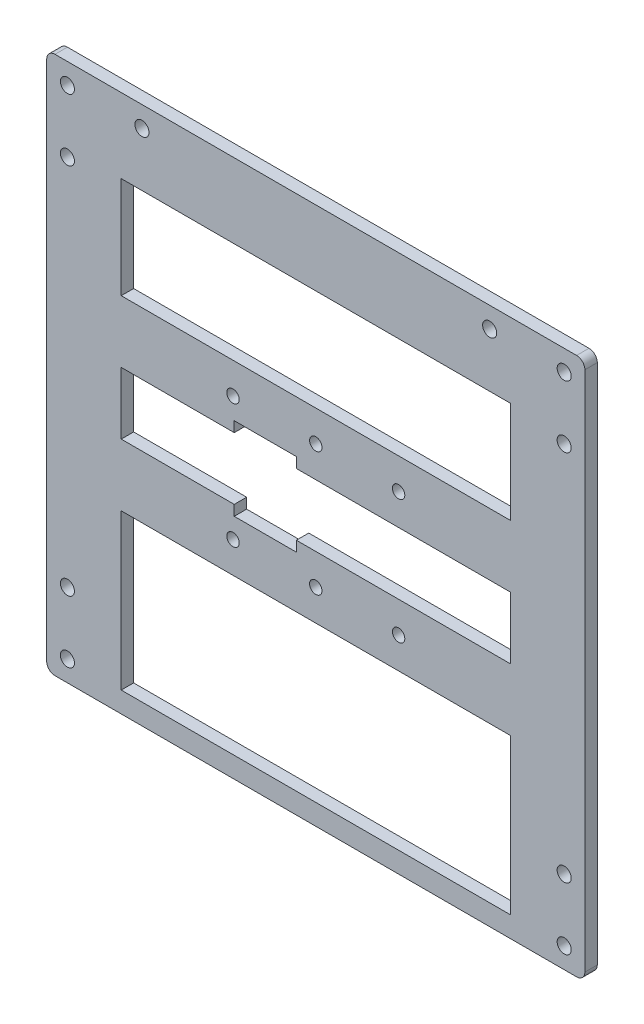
SolidWorks part; units mm, degrees
ref_plane "前视基准面" through (0, 0, 0) normal (0, 0, 1) x (1, 0, 0)
ref_plane "上视基准面" through (0, 0, 0) normal (0, 1, 0) x (1, 0, 0)
ref_plane "右视基准面" through (0, 0, 0) normal (1, 0, 0) x (0, 0, -1)
sketch "草图1" plane through (0, 0, 0) normal (0, 0, 1) x (1, 0, 0)
  line L1 (-65, 65) -> (65, 65)
  line L2 (-65, 65) -> (-65, -65)
  line L3 (-65, -65) -> (65, -65)
  line L4 (65, 65) -> (65, -65)
  line L5 (-65, 65) -> (65, -65) construction
  line L6 (-65, -65) -> (65, 65) construction
  point P0 (0, 0)
  dimension "D1" = 130
  dimension "D2" = 130
extrude "凸台-拉伸1" add sketch "草图1" along normal blind 3
hole_wizard "Ø3.0 (3) 直径孔1" positions "草图4" profile "草图3" hole size "Ø3.0" standard "GB"
sketch "草图4" plane through (0, 0, 3) normal (0, 0, 1) x (1, 0, 0)
  point P0 (-20, 15)
  point P3 (-20, -15)
  point P6 (20, -15)
  point P9 (20, 15)
  dimension "D1" = 40
  dimension "D2" = 40
  dimension "D3" = 30
  dimension "D4" = 30
  dimension "D5" = 15
  dimension "D6" = 20
  dimension "D7" = 20
  dimension "D8" = 15
sketch "草图3" plane through (-20, 15, 3) normal (1, 0, 0) x (0, -1, 0)
  line L0 (0, 0) -> (0, 3)
  line L1 (0, 3) -> (1.5, 3)
  line L2 (1.5, 3) -> (1.5, 0)
  line L5 (1.5, 0) -> (0, 0)
  line L11 (0, -6.35) -> (0, 107.95) construction
  dimension "通孔孔直径" = 3
  dimension "通孔孔深度" = 3
sketch "草图5" plane through (0, 0, 3) normal (0, 0, 1) x (1, 0, 0)
  line L1 (-47, 32.5) -> (47, 32.5)
  line L2 (-47, 32.5) -> (-47, 22.5)
  line L3 (-47, 22.5) -> (47, 22.5)
  line L4 (47, 32.5) -> (47, 22.5)
  line L5 (-47, 7.5) -> (47, 7.5)
  line L6 (-47, 7.5) -> (-47, -7.5)
  line L7 (-47, -7.5) -> (47, -7.5)
  line L8 (47, 7.5) -> (47, -7.5)
  line L9 (-47, 7.5) -> (47, -7.5) construction
  line L10 (-47, -7.5) -> (47, 7.5) construction
  line L11 (-47, -22.5) -> (47, -22.5)
  line L12 (-47, -22.5) -> (-47, -32.5)
  line L13 (-47, -32.5) -> (47, -32.5)
  line L14 (47, -22.5) -> (47, -32.5)
  point P4 (0, 0)
  dimension "D1" = 15
  dimension "D2" = 94
  dimension "D3" = 94
  dimension "D4" = 94
  dimension "D5" = 47
  dimension "D6" = 47
  dimension "D7" = 10
  dimension "D8" = 10
  dimension "D9" = 15
  dimension "D10" = 15
extrude "切除-拉伸1" cut sketch "草图5" against normal blind 3
sketch "草图6" plane through (0, 0, 0) normal (0, 0, -1) x (-1, 0, 0)
  line L0 (47, -7.5) -> (-47, -7.5) construction
  line L1 (19.2, -7.5) -> (7.2, -7.5)
  line L2 (19.2, -7.5) -> (19.2, -9.5)
  line L3 (19.2, -9.5) -> (7.2, -9.5)
  line L4 (7.2, -7.5) -> (7.2, -9.5)
  line L5 (-47, 7.5) -> (47, 7.5) construction
  line L6 (19.2, 7.5) -> (7.2, 7.5)
  line L7 (19.2, 7.5) -> (19.2, 9.5)
  line L8 (19.2, 9.5) -> (7.2, 9.5)
  line L9 (7.2, 7.5) -> (7.2, 9.5)
  line L10 (19.2, -7.5) -> (19.2, 7.5) construction
  dimension "D1" = 2
  dimension "D2" = 12
  dimension "D3" = 2
  dimension "D4" = 12
  dimension "D5" = 0
  dimension "D6" = 0
extrude "切除-拉伸2" cut sketch "草图6" against normal blind 3
fillet "圆角1" radius 3 4 edges at (-7.2, -9.5, 1.5) (-19.2, -9.5, 1.5) (-7.2, 9.5, 1.5) (-19.2, 9.5, 1.5)
sketch "草图7" plane through (0, 0, 0) normal (0, 0, -1) x (-1, 0, 0)
  line L1 (-47, 32.5) -> (47, 32.5)
  line L2 (-47, 32.5) -> (-47, 47)
  line L3 (-47, 47) -> (47, 47)
  line L4 (47, 32.5) -> (47, 47)
extrude "切除-拉伸3" cut sketch "草图7" against normal blind 3
sketch "草图8" plane through (0, 0, 3) normal (0, 0, 1) x (1, 0, 0)
  line L1 (-47, -32.5) -> (47, -32.5)
  line L2 (-47, -32.5) -> (-47, -60)
  line L3 (-47, -60) -> (47, -60)
  line L4 (47, -32.5) -> (47, -60)
  line L6 (-65, -65) -> (65, -65) construction
  line L7 (47, -47) -> (47, 47) construction
  line L8 (-47, 47) -> (-47, -47) construction
  line L9 (-47, -32.5) -> (47, -32.5) construction
  dimension "D1" = 5
  dimension "D2" = 0
extrude "切除-拉伸4" cut sketch "草图8" against normal blind 3
hole_wizard "Ø3.0 (3) 直径孔2" positions "草图9" profile "草图10" hole size "Ø3.0" standard "GB"
sketch "草图9" plane through (0, 0, 3) normal (0, 0, 1) x (1, 0, 0)
  line L0 (47, 7.5) -> (-7.2, 7.5) construction
  line L1 (-7.2, -7.5) -> (47, -7.5) construction
  point P0 (0, -15)
  point P2 (0, 15)
  dimension "D1" = 7.5
  dimension "D2" = 7.5
sketch "草图10" plane through (0, -15, 3) normal (1, 0, 0) x (0, -1, 0)
  line L0 (0, 0) -> (0, 3)
  line L1 (0, 3) -> (1.5, 3)
  line L2 (1.5, 3) -> (1.5, 0)
  line L5 (1.5, 0) -> (0, 0)
  line L11 (0, -6.35) -> (0, 107.95) construction
  dimension "通孔孔直径" = 3
  dimension "通孔孔深度" = 3
sketch "草图11" plane through (0, 0, 0) normal (0, 0, -1) x (-1, 0, 0)
  line L0 (19.2, 7.5) -> (47, 7.5) construction
  line L1 (4.7, 10) -> (19.7, 10)
  line L2 (4.7, 10) -> (4.7, 7.5)
  line L3 (4.7, 7.5) -> (19.7, 7.5)
  line L4 (19.7, 10) -> (19.7, 7.5)
  line L5 (19.7, -10) -> (19.7, 10) construction
  line L6 (47, -7.5) -> (19.2, -7.5) construction
  line L7 (4.7, -10) -> (19.7, -10)
  line L8 (4.7, -10) -> (4.7, -7.5)
  line L9 (4.7, -7.5) -> (19.7, -7.5)
  line L10 (19.7, -10) -> (19.7, -7.5)
extrude "切除-拉伸5" cut sketch "草图11" against normal through all
fillet "圆角2" radius 2 4 edges at (65, -65, 1.5) (-65, -65, 1.5) (-65, 65, 1.5) (65, 65, 1.5)
hole_wizard "Ø3.4 (3.4) 直径孔1" positions "草图12" profile "草图13" hole size "Ø3.4" standard "GB"
sketch "草图12" plane through (0, 0, 0) normal (0, 0, -1) x (-1, 0, 0)
  line L0 (-63, 65) -> (63, 65) construction
  line L1 (-65, -63) -> (-65, 63) construction
  line L2 (65, 63) -> (65, -63) construction
  line L3 (63, -65) -> (-63, -65) construction
  point P0 (-60, 60)
  point P2 (60, 60)
  point P4 (60, -60)
  point P6 (-60, -60)
  dimension "D1" = 5
  dimension "D2" = 5
  dimension "D3" = 5
  dimension "D4" = 5
  dimension "D5" = 5
  dimension "D6" = 5
  dimension "D7" = 5
  dimension "D8" = 5
sketch "草图13" plane through (60, 60, 0) normal (1, 0, 0) x (0, 1, 0)
  line L0 (0, 0) -> (0, 3)
  line L1 (0, 3) -> (1.7, 3)
  line L2 (1.7, 3) -> (1.7, 0)
  line L5 (1.7, 0) -> (0, 0)
  line L11 (0, -6.35) -> (0, 107.95) construction
  dimension "通孔孔直径" = 3.4
  dimension "通孔孔深度" = 3
hole_wizard "Ø3.4 (3.4) 直径孔2" positions "草图14" profile "草图15" hole size "Ø3.4" standard "GB"
sketch "草图14" plane through (0, 0, 3) normal (0, 0, 1) x (1, 0, 0)
  point P0 (60, 45)
  point P3 (60, -45)
  point P6 (-60, -45)
  point P11 (-42, 60)
  point P14 (42, 60)
  point P19 (-60, 45)
sketch "草图15" plane through (60, 45, 3) normal (1, 0, 0) x (0, -1, 0)
  line L0 (0, 0) -> (0, 3)
  line L1 (0, 3) -> (1.7, 3)
  line L2 (1.7, 3) -> (1.7, 0)
  line L5 (1.7, 0) -> (0, 0)
  line L11 (0, -6.35) -> (0, 107.95) construction
  dimension "通孔孔直径" = 3.4
  dimension "通孔孔深度" = 3
